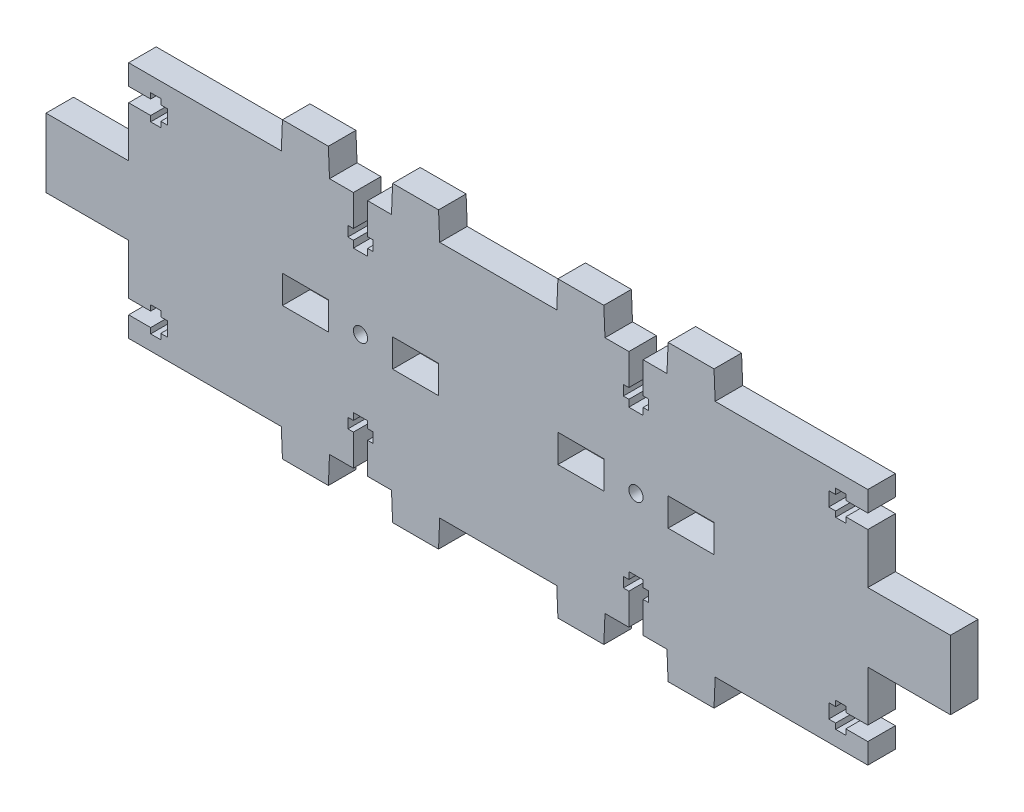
SolidWorks part; units mm, degrees
ref_plane "Спереди" through (0, 0, 0) normal (0, 0, 1) x (1, 0, 0)
ref_plane "Сверху" through (0, 0, 0) normal (0, 1, 0) x (1, 0, 0)
ref_plane "Справа" through (0, 0, 0) normal (1, 0, 0) x (0, 0, -1)
sketch "Эскиз1" plane through (0, 0, 0) normal (0, 0, 1) x (1, 0, 0)
  line L0 (0, 84.7298) -> (0, 0) construction
  line L1 (0, 0) -> (159.715, 0) construction
  line L2 (0, 0) -> (12.75, 0)
  line L3 (80.5, 0) -> (80.5, 4.45)
  line L4 (80.5, 52) -> (47.25, 52)
  line L5 (12.75, 0) -> (13, -6)
  line L6 (13, -6) -> (23, -6)
  line L7 (23, -6) -> (23.25, 0)
  line L8 (30, 0) -> (30, 18.5174) construction
  line L9 (23.25, 0) -> (28.45, 0)
  line L10 (47.25, 0) -> (47, -6)
  line L11 (47, -6) -> (37, -6)
  line L12 (37, -6) -> (36.75, 0)
  line L13 (18, -6) -> (18, 9.5634) construction
  line L14 (31.55, 0) -> (31.55, 6.8)
  line L15 (31.55, 6.8) -> (32.75, 6.8)
  line L16 (32.75, 6.8) -> (32.75, 9)
  line L17 (32.75, 9) -> (31.55, 9)
  line L18 (31.55, 9) -> (31.55, 10.5)
  line L19 (31.55, 10.5) -> (28.45, 10.5)
  line L20 (31.55, 0) -> (36.75, 0)
  line L21 (47.25, 0) -> (80.5, 0)
  line L22 (28.45, 9) -> (28.45, 10.5)
  line L23 (27.25, 9) -> (28.45, 9)
  line L24 (27.25, 6.8) -> (27.25, 9)
  line L25 (28.45, 6.8) -> (27.25, 6.8)
  line L26 (28.45, 0) -> (28.45, 6.8)
  line L27 (0, 0) -> (0, 52)
  line L28 (80.5, 33.5) -> (98.5, 33.5)
  line L29 (98.5, 33.5) -> (98.5, 18.5)
  line L30 (98.5, 18.5) -> (80.5, 18.5)
  line L31 (80.5, 33.5) -> (80.5, 44.45)
  line L32 (98.5, 26) -> (0, 26) construction
  line L33 (80.5, 47.55) -> (75.7, 47.55)
  line L34 (28.45, 52) -> (28.45, 45.2)
  line L35 (28.45, 45.2) -> (27.25, 45.2)
  line L36 (27.25, 45.2) -> (27.25, 43)
  line L37 (27.25, 43) -> (28.45, 43)
  line L38 (28.45, 43) -> (28.45, 41.5)
  line L39 (31.55, 41.5) -> (28.45, 41.5)
  line L40 (31.55, 43) -> (31.55, 41.5)
  line L41 (32.75, 43) -> (31.55, 43)
  line L42 (32.75, 45.2) -> (32.75, 43)
  line L43 (31.55, 45.2) -> (32.75, 45.2)
  line L44 (31.55, 52) -> (31.55, 45.2)
  line L45 (75.7, 47.55) -> (75.7, 48.75)
  line L46 (37, 58) -> (36.75, 52)
  line L47 (47, 58) -> (37, 58)
  line L48 (47.25, 52) -> (47, 58)
  line L49 (23, 58) -> (23.25, 52)
  line L50 (13, 58) -> (23, 58)
  line L51 (12.75, 52) -> (13, 58)
  line L52 (12.75, 52) -> (0, 52)
  line L53 (28.45, 52) -> (23.25, 52)
  line L54 (36.75, 52) -> (31.55, 52)
  line L55 (75.7, 48.75) -> (73.5, 48.75)
  line L56 (73.5, 48.75) -> (73.5, 47.55)
  line L57 (73.5, 47.55) -> (72, 47.55)
  line L58 (72, 44.45) -> (72, 47.55)
  line L59 (73.5, 44.45) -> (72, 44.45)
  line L60 (73.5, 43.25) -> (73.5, 44.45)
  line L61 (75.7, 43.25) -> (73.5, 43.25)
  line L62 (75.7, 44.45) -> (75.7, 43.25)
  line L63 (80.5, 44.45) -> (75.7, 44.45)
  line L64 (80.5, 47.55) -> (80.5, 52)
  line L65 (72, 46) -> (87.4928, 46) construction
  line L66 (80.5, 7.55) -> (75.7, 7.55)
  line L67 (75.7, 7.55) -> (75.7, 8.75)
  line L68 (75.7, 8.75) -> (73.5, 8.75)
  line L69 (73.5, 8.75) -> (73.5, 7.55)
  line L70 (73.5, 7.55) -> (72, 7.55)
  line L71 (72, 7.55) -> (72, 4.45)
  line L72 (73.5, 4.45) -> (72, 4.45)
  line L73 (73.5, 3.25) -> (73.5, 4.45)
  line L74 (75.7, 3.25) -> (73.5, 3.25)
  line L75 (75.7, 4.45) -> (75.7, 3.25)
  line L76 (80.5, 4.45) -> (75.7, 4.45)
  line L77 (80.5, 7.55) -> (80.5, 18.5)
  line L78 (23, 29.05) -> (13, 29.05)
  line L79 (37, 22.95) -> (47, 22.95)
  line L80 (37, 22.95) -> (37, 29.05)
  line L81 (37, 29.05) -> (47, 29.05)
  line L82 (47, 22.95) -> (47, 29.05)
  line L83 (37, 22.95) -> (47, 29.05) construction
  line L84 (37, 29.05) -> (47, 22.95) construction
  line L85 (23, 29.05) -> (13, 22.95) construction
  line L86 (23, 22.95) -> (13, 29.05) construction
  line L87 (13, 22.95) -> (13, 29.05)
  line L88 (23, 22.95) -> (23, 29.05)
  line L89 (23, 22.95) -> (13, 22.95)
  circle A0 centre (30, 26) radius 1.55
  point P83 (42, 26)
  dimension "D19" = 3.1
  dimension "D1" = 52
  dimension "D2" = 161
  dimension "D3" = 10
  dimension "D4" = 6
  dimension "D5" = 10.5
  dimension "D6" = 12
  dimension "D7" = 10.5
  dimension "D8" = 5.5
  dimension "D9" = 3.1
  dimension "D10" = 2.2
  dimension "D11" = 1.5
  dimension "D12" = 30
  dimension "D13" = 15
  dimension "D14" = 18
  dimension "D15" = 8.5
  dimension "D16" = 20
  dimension "D17" = 10
  dimension "D18" = 6.1
  dimension "D20" = 24
extrude "Бобышка-Вытянуть1" add sketch "Эскиз1" along normal blind 6
mirror "Зеркальное отражение1" about plane through (0, 0, 6) normal (1, 0, 0)
